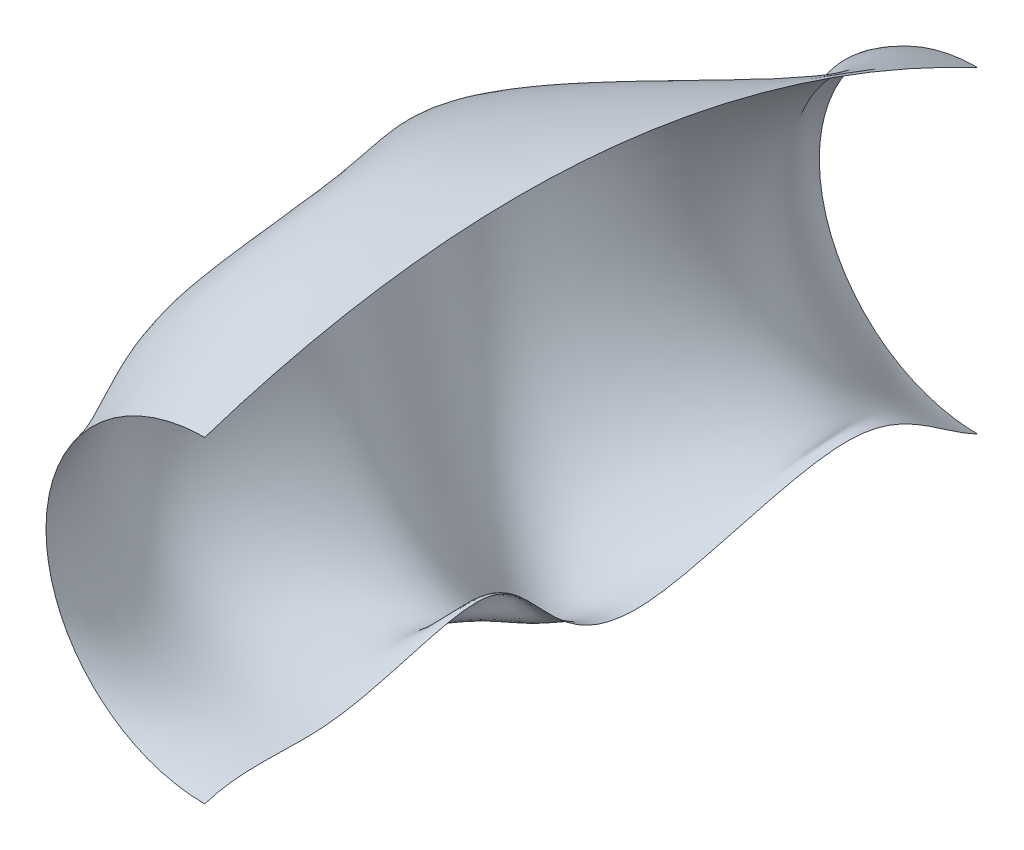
SolidWorks part; units mm, degrees
ref_plane "Vorne" through (0, 0, 0) normal (0, 0, 1) x (1, 0, 0)
ref_plane "Oben" through (0, 0, 0) normal (0, 1, 0) x (1, 0, 0)
ref_plane "Rechts" through (0, 0, 0) normal (1, 0, 0) x (0, 0, -1)
sketch "Skizze1" plane through (0, 0, 0) normal (1, 0, 0) x (0, 0, -1)
  line L0 (0, 0) -> (0, 18.3632) construction
  spline S0 degree 2 poles (0, 18.3632) (56.4395, 36.8081) (108.9465, 8.9967) knots 0 0 0 1 1 1
sketch "Skizze2" plane through (0, 0, 0) normal (0, 0, 1) x (1, 0, 0)
  arc A0 (0, 18.3632) -> (0, -26.355) centre (0, -3.9959) ccw
surface "Oberfläche-Austragung1"
other "Freiform1"
